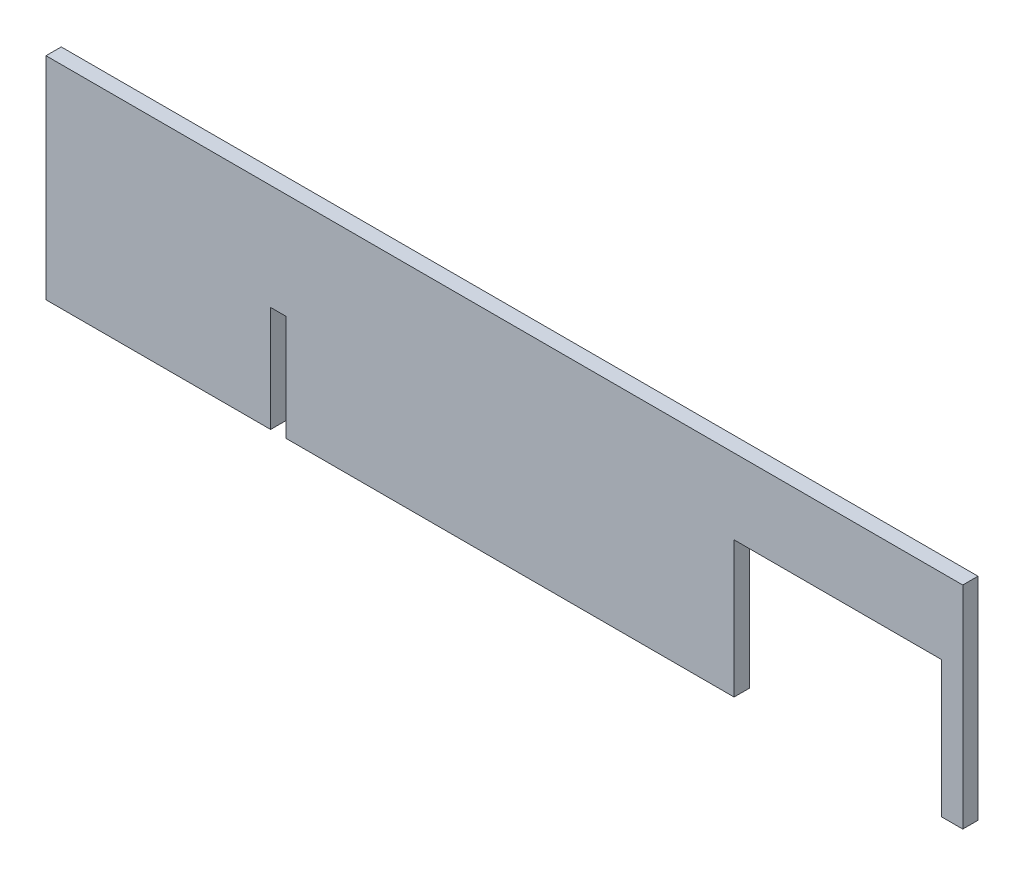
SolidWorks part; units mm, degrees
ref_plane "Front Plane" through (0, 0, 0) normal (0, 0, 1) x (1, 0, 0)
ref_plane "Top Plane" through (0, 0, 0) normal (0, 1, 0) x (1, 0, 0)
ref_plane "Right Plane" through (0, 0, 0) normal (1, 0, 0) x (0, 0, -1)
sketch "Sketch1" plane through (0, 0, 0) normal (0, 0, 1) x (1, 0, 0)
  line L1 (0, 0) -> (-229.108, 0)
  line L2 (0, 0) -> (0, 52.832)
  line L3 (0, 52.832) -> (-229.108, 52.832)
  line L4 (-229.108, 0) -> (-229.108, 52.832)
  dimension "D1" = 52.832
  dimension "D2" = 229.108
extrude "Extrude1" add sketch "Sketch1" along normal blind 3.81
sketch "Sketch2" plane through (0, 0, 0) normal (0, 0, 1) x (1, 0, 0)
  line L0 (-229.108, 52.832) -> (-229.108, 0) construction
  line L1 (-172.974, -8.0573) -> (-169.164, -8.0573)
  line L2 (-172.974, -8.0573) -> (-172.974, 26.416)
  line L3 (-172.974, 26.416) -> (-169.164, 26.416)
  line L4 (-169.164, -8.0573) -> (-169.164, 26.416)
  line L5 (0, 52.832) -> (-229.108, 52.832) construction
  line L6 (0, 0) -> (0, 52.832) construction
  line L7 (-5.334, -0.4373) -> (-57.15, -0.4373)
  line L8 (-5.334, -0.4373) -> (-5.334, 34.036)
  line L9 (-5.334, 34.036) -> (-57.15, 34.036)
  line L10 (-57.15, -0.4373) -> (-57.15, 34.036)
  dimension "D1" = 56.134
  dimension "D2" = 3.81
  dimension "D3" = 26.416
  dimension "D4" = 5.334
  dimension "D5" = 18.796
  dimension "D6" = 51.816
extrude "Cut-Extrude1" cut sketch "Sketch2" along normal through all
